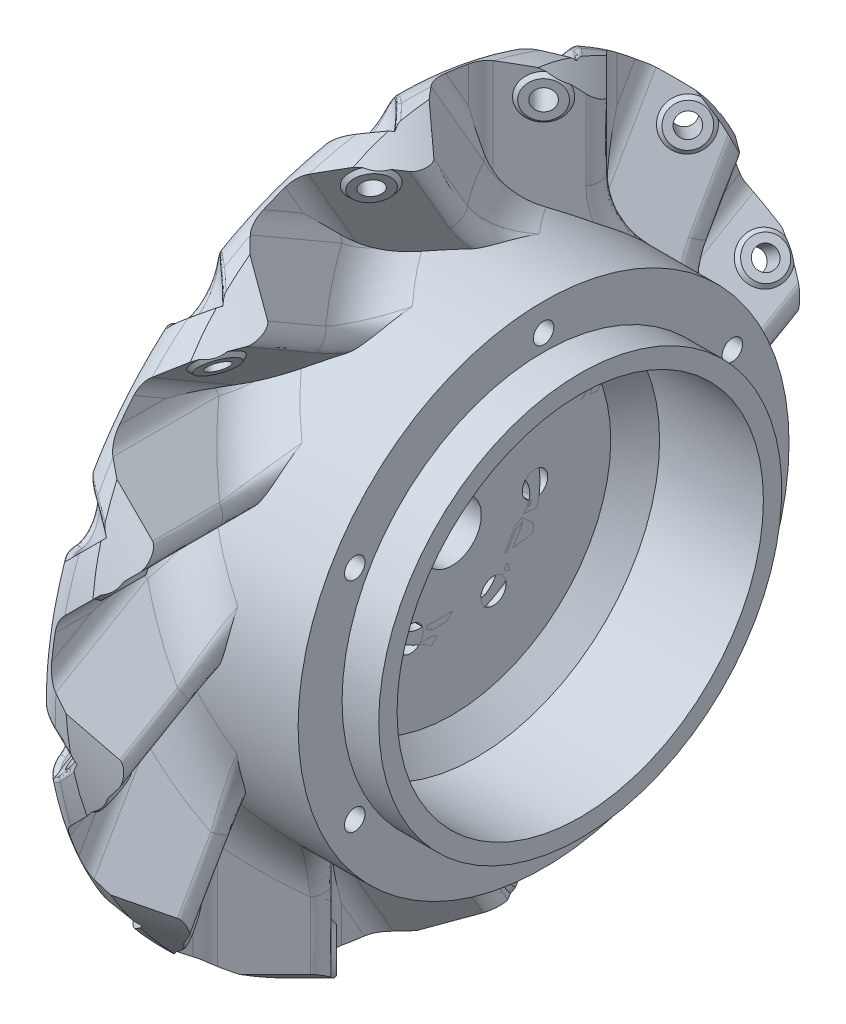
SolidWorks part; units mm, degrees
other "<MecanumB_pieza>-<<MecanumA_pieza>-<Redondeo7>>"
other "<MecanumB_pieza>-<Volumenkörper1[1]>"
ref_plane "Alzado" through (0, 0, 0) normal (0, 0, 1) x (1, 0, 0)
ref_plane "Planta" through (0, 0, 0) normal (0, 1, 0) x (1, 0, 0)
ref_plane "Vista lateral" through (0, 0, 0) normal (1, 0, 0) x (0, 0, -1)
ref_plane "Alzado-MecanumB_pieza_Simétrica" through (0, 0, 0) normal (0, 0, -1) x (1, 0, 0)
ref_plane "Planta-MecanumB_pieza_Simétrica" through (0, 0, 0) normal (0, 1, 0) x (1, 0, 0)
ref_plane "Vista lateral-MecanumB_pieza_Simétrica" through (0, 0, 0) normal (1, 0, 0) x (0, 0, 1)
mirrored part "MecanumB_pieza_Simétrica"
